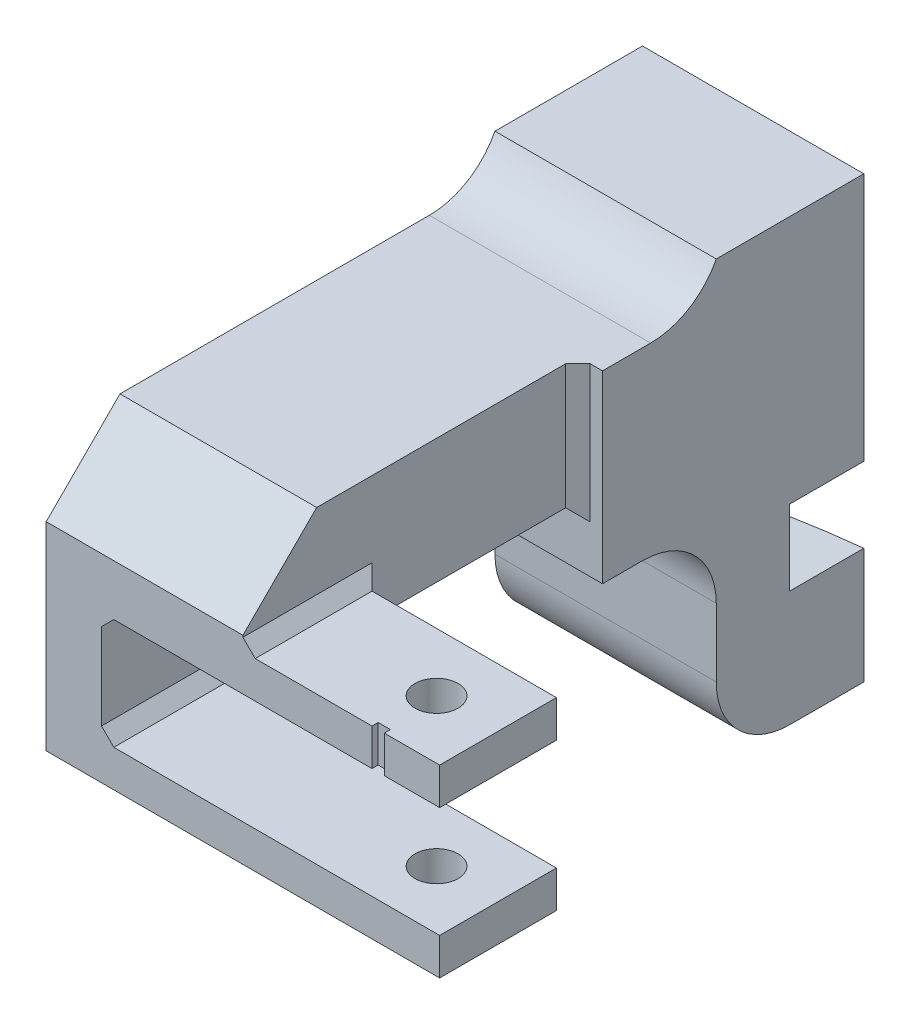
SolidWorks part; units mm, degrees
ref_plane "Alzado" through (0, 0, 0) normal (0, 0, 1) x (1, 0, 0)
ref_plane "Planta" through (0, 0, 0) normal (0, 1, 0) x (1, 0, 0)
ref_plane "Vista lateral" through (0, 0, 0) normal (1, 0, 0) x (0, 0, -1)
sketch "Croquis1" plane through (0, 0, 0) normal (0, 0, 1) x (1, 0, 0)
  line L0 (0, 17.9) -> (0, -17.9) construction
  line L1 (-9, 17.9) -> (9, 17.9)
  line L2 (-9, 17.9) -> (-9, -17.9)
  line L3 (-9, -17.9) -> (9, -17.9)
  line L4 (9, 17.9) -> (9, -17.9)
  dimension "D1" = 18
  dimension "D2" = 35.8
  dimension "D3" = 17.9
extrude "Saliente-Extruir1" add sketch "Croquis1" along normal blind 12
sketch "Croquis2" plane through (0, 0, 0) normal (0, 0, -1) x (-1, 0, 0)
  line L0 (-18, -102) -> (-18, -1.95) construction
  line L2 (-9, -17.9) -> (-9, 17.9) construction
  circle A0 centre (-18, -102) radius 93.95
  circle A1 centre (-18, -102) radius 100.05
  dimension "D1" = 200.1
  dimension "D2" = 187.9
  dimension "D3" = 9
  dimension "D4" = 102
extrude "Cortar-Extruir1" cut sketch "Croquis2" against normal blind 6.05
sketch "Croquis5" plane through (0, 0, 12) normal (0, 0, 1) x (1, 0, 0)
  line L0 (9, -17.9) -> (9, 17.9) construction
  line L1 (-9, 14.6444) -> (9, 14.6444)
  line L2 (-9, 14.6444) -> (-9, -0.3556)
  line L3 (-9, -0.3556) -> (9, -0.3556)
  line L4 (9, 14.6444) -> (9, -0.3556)
  line L5 (-9, 14.6444) -> (9, -0.3556) construction
  line L6 (-9, -0.3556) -> (9, 14.6444) construction
  line L7 (9, -2.3556) -> (9, -0.3556) construction
  arc A0 (9, -2.3556) -> (-9, -5.662) centre (18, -102) ccw construction
  point P0 (0, 7.1444)
  dimension "D1" = 15
  dimension "D2" = 2
extrude "Saliente-Extruir2" add sketch "Croquis5" along normal blind 36.5 contours L1 L4 L3 L2
sketch "Croquis10" plane through (0, 0, 48.5) normal (0, 0, 1) x (1, 0, 0)
  line L0 (-9, 14.6444) -> (9, 14.6444)
  line L1 (9, 14.6444) -> (9, 17.9) construction
  line L2 (9, 14.6444) -> (9, -0.3556) construction
  line L3 (9, 14.6444) -> (9, 7.5)
  line L4 (9, 7.5) -> (23, 7.5)
  line L5 (23, 7.5) -> (23, -7.5)
  line L6 (23, -7.5) -> (-9, -7.5)
  line L7 (-9, -0.3556) -> (-9, -17.9) construction
  line L8 (-9, -7.5) -> (-9, 14.6444)
  line L9 (23, 0) -> (0, 0) construction
  line L10 (23, 4.5) -> (-4.5, 4.5) construction
  line L11 (-4.5, 4.5) -> (-4.5, -4.5) construction
  line L12 (-4.5, -4.5) -> (23, -4.5) construction
  line L13 (18, 7.5) -> (18, -7.5) construction
  line L14 (9, -17.9) -> (9, -0.3556) construction
  line L15 (23, 7.5) -> (23, 4.5) construction
  line L16 (23, -4.5) -> (23, -7.5) construction
  dimension "D1" = 15
  dimension "D2" = 32
  dimension "D3" = 3
  dimension "D4" = 3
  dimension "D5" = 9
  dimension "D6" = 22.5
extrude "Saliente-Extruir3" add sketch "Croquis10" against normal blind 9.5
sketch "Croquis11" plane through (0, 0, 48.5) normal (0, 0, 1) x (1, 0, 0)
  line L0 (-4.5, -4.5) -> (23, -4.5) construction
  line L1 (-4.5, 4.5) -> (-4.5, -4.5) construction
  line L2 (23, 4.5) -> (-4.5, 4.5) construction
  line L3 (-4.5, -4.5) -> (23, -4.5)
  line L4 (-4.5, 4.5) -> (-4.5, -4.5)
  line L5 (23, 4.5) -> (-4.5, 4.5)
  line L6 (23, 4.5) -> (23, -4.5)
extrude "Cortar-Extruir2" cut sketch "Croquis11" against normal blind 27.25 contours L5 L4 L3 L6
sketch "Croquis12" plane through (0, -7.5, 0) normal (0, -1, 0) x (1, 0, 0)
  line L0 (23, 43.75) -> (18, 43.75) construction
  line L1 (23, 39) -> (23, 48.5) construction
  line L2 (9, 12) -> (9, 0) construction
  circle A0 centre (18, 43.75) radius 1.75
  dimension "D1" = 9
  dimension "D2" = 3.5
extrude "Cortar-Extruir3" cut sketch "Croquis12" against normal through all
fillet "Redondeo1" radius 6 3 edges at (0, -0.3556, 12) (0, -17.9, 12) (0, 14.6444, 12)
chamfer "Chaflán1" distance 6 angle 45 1 edges at (0, 14.6444, 48.5)
sketch "Croquis13" plane through (9, 0, 0) normal (1, 0, 0) x (0, 0, -1)
  line L0 (-42.5, 14.6444) -> (-17.3356, 14.6444) construction
  line L1 (-21.25, 14.6444) -> (-42.5, 14.6444)
  line L2 (-21.25, 14.6444) -> (-21.25, -0.3556)
  line L3 (-21.25, -0.3556) -> (-39, -0.3556)
  line L4 (-39, 7.5) -> (-48.5, 7.5) construction
  line L6 (-21.25, -0.3556) -> (-21.25, 4.5) construction
  line L7 (-48.5, 8.6444) -> (-48.5, 7.5) construction
  line L8 (-42.5, 14.6444) -> (-48.5, 8.6444) construction
  line L9 (-39, 7.5) -> (-48.5, 7.5)
  line L10 (-48.5, 8.6444) -> (-48.5, 7.5)
  line L11 (-42.5, 14.6444) -> (-48.5, 8.6444)
  line L12 (-39, 7.5) -> (-39, -0.3556)
extrude "Cortar-Extruir4" cut sketch "Croquis13" against normal blind 2
chamfer "Chaflán2" distance 1 angle 45 8 edges at (-4.5, 2.0722, 21.25) (1.25, 4.5, 21.25) (7, 9.5722, 21.25) (-4.5, -4.5, 43.75) (7, 6, 39) (7, 7.5, 43.75) (-4.5, 4.5, 34.875) (-6.75, -0.3556, 39)
sketch "Croquis14" plane through (0, 0, 48.5) normal (0, 0, 1) x (1, 0, 0)
  line L0 (23, 7.5) -> (8, 7.5) construction
  line L1 (18.5, 4.5) -> (17.5, 4.5)
  line L2 (18.5, 4.5) -> (18.5, 7.5)
  line L3 (18.5, 7.5) -> (17.5, 7.5)
  line L4 (17.5, 4.5) -> (17.5, 7.5)
  line L5 (18.5, 4.5) -> (17.5, 7.5) construction
  line L6 (18.5, 7.5) -> (17.5, 4.5) construction
  line L7 (23, 4.5) -> (-3.5, 4.5) construction
  line L8 (9, -0.3556) -> (9, 14.6444) construction
  point P0 (18, 6)
  dimension "D1" = 9
  dimension "D2" = 1
extrude "Cortar-Extruir5" cut sketch "Croquis14" against normal blind 0.5
